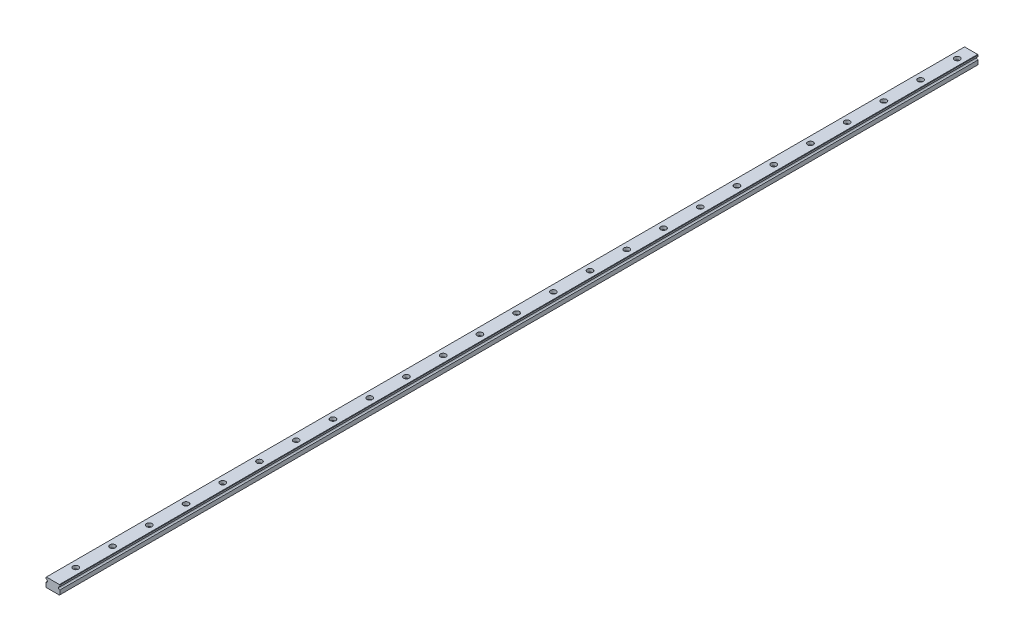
SolidWorks part; units mm, degrees
ref_plane "Front Plane" through (0, 0, 0) normal (0, 0, 1) x (1, 0, 0)
ref_plane "Top Plane" through (0, 0, 0) normal (0, 1, 0) x (1, 0, 0)
ref_plane "Right Plane" through (0, 0, 0) normal (1, 0, 0) x (0, 0, -1)
sketch "Sketch2" plane through (0, 0, 0) normal (0, 0, 1) x (1, 0, 0)
  line L0 (1.1131, -5.0934) -> (6.9131, -5.0934)
  line L1 (6.9131, -5.0934) -> (7.3131, -4.6934)
  line L2 (7.3131, -4.6934) -> (7.3131, -0.0934)
  line L3 (7.3131, 2.9066) -> (7.3131, 4.5066)
  line L4 (7.3131, 4.5066) -> (6.9131, 4.9066)
  line L5 (6.9131, 4.9066) -> (-7.2869, 4.9066)
  line L6 (-7.2869, 4.9066) -> (-7.6869, 4.5066)
  line L7 (-7.6869, 4.5066) -> (-7.6869, 2.9066)
  line L8 (-7.6869, -0.0934) -> (-7.6869, -4.6934)
  line L9 (-7.6869, -4.6934) -> (-7.2869, -5.0934)
  line L10 (-7.2869, -5.0934) -> (0.5131, -5.0934)
  line L11 (0.5131, -5.0934) -> (1.1131, -5.0934)
  arc A0 (5.8131, 1.4066) -> (7.3131, -0.0934) centre (7.3131, 1.4066) ccw
  arc A1 (7.3131, 2.9066) -> (5.8131, 1.4066) centre (7.3131, 1.4066) ccw
  arc A2 (-7.6869, -0.0934) -> (-7.6869, 2.9066) centre (-7.6869, 1.4066) ccw
extrude "Boss-Extrude1" add sketch "Sketch2" along normal blind 1000
sketch "Sketch3" plane through (0, 4.9066, 0) normal (0, 1, 0) x (1, 0, 0)
  line L0 (7.3131, -1000) -> (7.3131, 0) construction
  line L2 (6.9131, 0) -> (-7.2869, 0) construction
  point P0 (-0.1869, -15)
  dimension "D1" = 7.5
  dimension "D2" = 15
hole_wizard "CBORE for M16 Hex Head Bolt1" positions "Sketch3" profile "Sketch4" counterbore size "M16" standard "DIN"
sketch "Sketch4" plane through (-0.1869, 4.9066, 15) normal (1, 0, 0) x (0, 0, 1)
  line L0 (0, 0) -> (0, 10)
  line L1 (0, 10) -> (1.75, 10)
  line L3 (1.75, 10) -> (1.75, 3.5)
  line L4 (1.75, 3.5) -> (3, 3.5)
  line L5 (3, 3.5) -> (3, 0)
  line L7 (3, 0) -> (0, 0)
  line L11 (0, -6.35) -> (0, 107.95) construction
  dimension "Thru Hole Dia." = 3.5
  dimension "Thru Hole Depth" = 10
  dimension "C'Bore Dia." = 6
  dimension "C'Bore Depth" = 3.5
other "Fill Pattern1" parameters "D5"=0, "D6"=0, "D1"=40, "D2"=60, "D3"=0, "D9"=25, "D7"=25, "D8"=2
